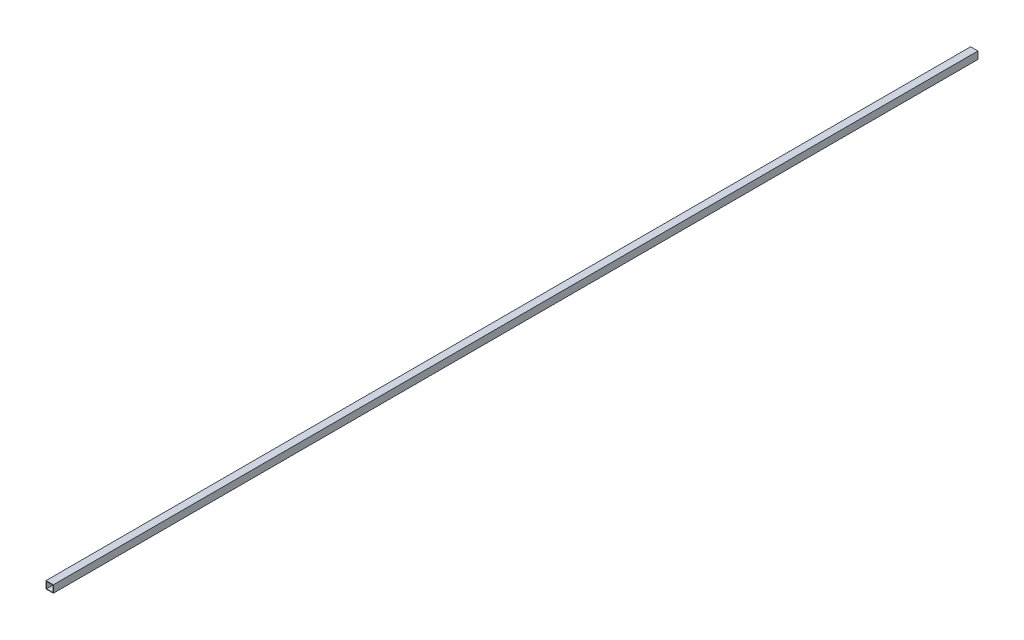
SolidWorks part; units mm, degrees
ref_plane "Plan de face" through (0, 0, 0) normal (0, 0, 1) x (1, 0, 0)
ref_plane "Plan de dessus" through (0, 0, 0) normal (0, 1, 0) x (1, 0, 0)
ref_plane "Plan de droite" through (0, 0, 0) normal (1, 0, 0) x (0, 0, -1)
sketch "Esquisse1" plane through (0, 0, 0) normal (0, 0, 1) x (1, 0, 0)
  line L0 (-35, 35) -> (35, 35)
  line L1 (-40, 40) -> (40, 40)
  line L2 (-40, 40) -> (-40, -40)
  line L3 (-40, -40) -> (40, -40)
  line L4 (40, 40) -> (40, -40)
  line L5 (0, 0) -> (0, 53.2039) construction
  line L6 (0, 0) -> (64.6543, 0) construction
  line L7 (35, 35) -> (35, -35)
  line L8 (-35, -35) -> (35, -35)
  line L9 (-35, 35) -> (-35, -35)
  dimension "D1" = 40
  dimension "D2" = 40
  dimension "D3" = 80
  dimension "D4" = 5
extrude "Boss.-Extru.1" add sketch "Esquisse1" against normal blind 10080
